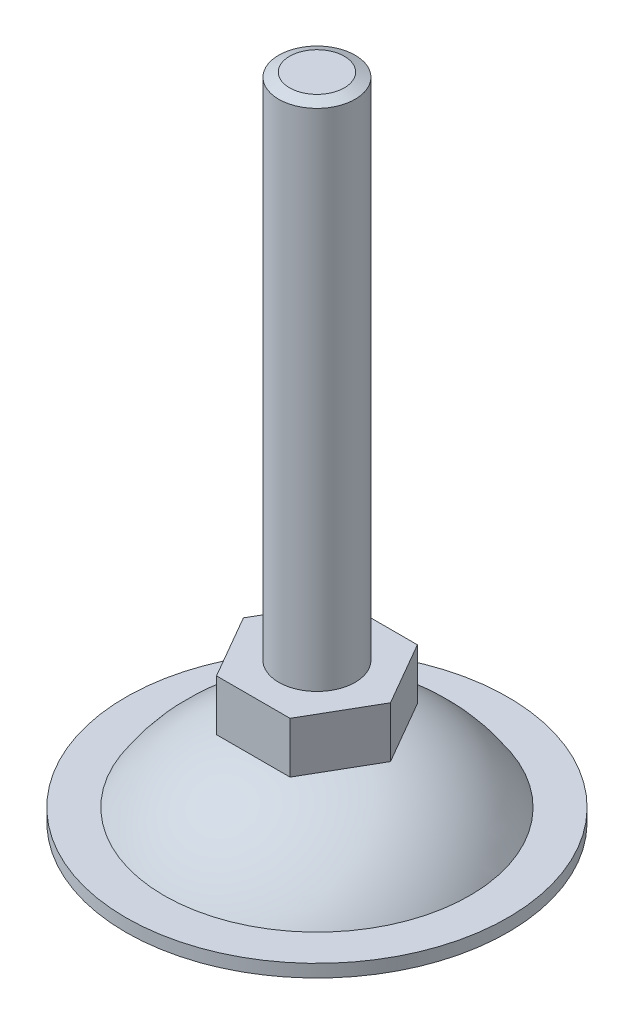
SolidWorks part; units mm, degrees
ref_plane "正面" through (0, 0, 0) normal (0, 0, 1) x (1, 0, 0)
ref_plane "平面" through (0, 0, 0) normal (0, 1, 0) x (1, 0, 0)
ref_plane "右側面" through (0, 0, 0) normal (1, 0, 0) x (0, 0, -1)
sketch "ｽｹｯﾁ1" plane through (0, 0, 0) normal (1, 0, 0) x (0, 0, -1)
  line L7 (0, 51) -> (0, 0)
  line L8 (3, 6.9026) -> (3, 50.65)
  line L9 (0, 0) -> (15, 0)
  line L10 (12, 1) -> (15, 1)
  line L11 (15, 1) -> (15, 0)
  line L12 (0, 51) -> (2.15, 51)
  line L13 (3, 50.65) -> (2.15, 51)
  arc A1 (12, 1) -> (3, 6.9026) centre (1.0851, -5.8297) ccw
  dimension "D1" = 3
  dimension "D2" = 51
revolve "回転1" add sketch "ｽｹｯﾁ1" angle 360 about L7
ref_plane "平面1" through (0, 7, 0) normal (0, -1, 0) x (1, 0, 0)
sketch "ｽｹｯﾁ2" plane through (0, 7, 0) normal (0, -1, 0) x (1, 0, 0)
  line L6 (2.8868, -5) -> (5.7735, 0)
  line L7 (-2.8868, -5) -> (-5.7735, 0)
  line L8 (2.8868, -5) -> (-2.8868, -5)
  line L9 (2.8868, 5) -> (-2.8868, 5)
  line L10 (-5.7735, 0) -> (-2.8868, 5)
  line L11 (5.7735, 0) -> (2.8868, 5)
extrude "押し出し1" add sketch "ｽｹｯﾁ2" against normal blind 4
